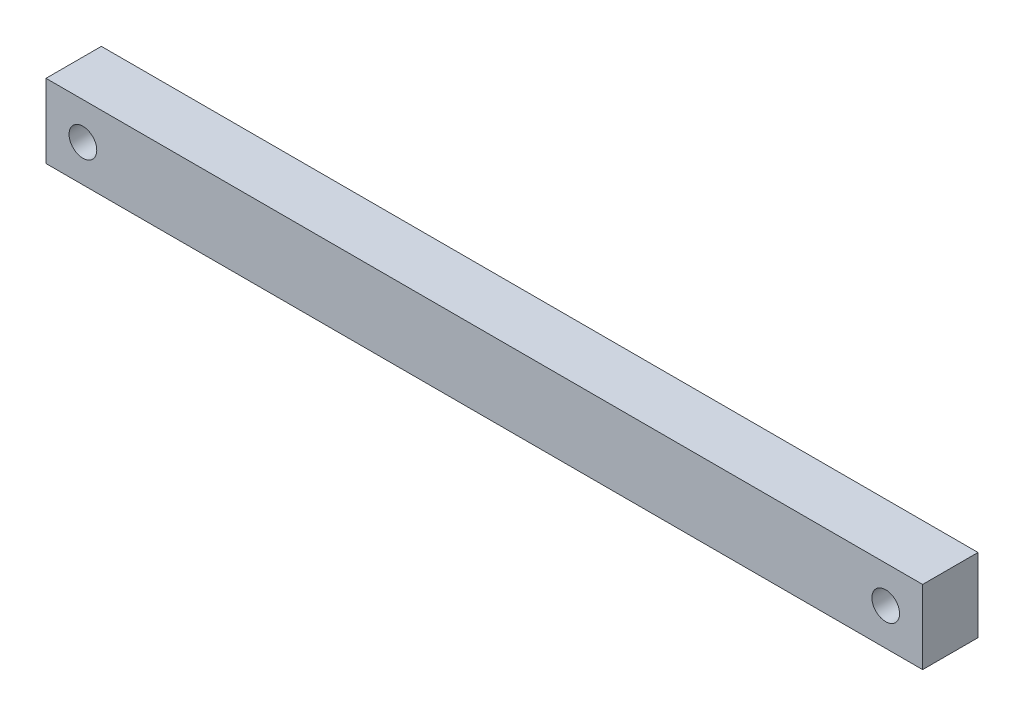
SolidWorks part; units mm, degrees
ref_plane "Plan de face" through (0, 0, 0) normal (0, 0, 1) x (1, 0, 0)
ref_plane "Plan de dessus" through (0, 0, 0) normal (0, 1, 0) x (1, 0, 0)
ref_plane "Plan de droite" through (0, 0, 0) normal (1, 0, 0) x (0, 0, -1)
sketch "Esquisse1" plane through (0, 0, 0) normal (0, 0, 1) x (1, 0, 0)
  line L0 (0, 0) -> (87, 87) construction
  line L1 (0, 0) -> (87, 0) construction
  line L2 (0, 0) -> (0, 87) construction
  line L3 (0, 87) -> (87, 87) construction
  line L4 (87, 0) -> (87, 87) construction
  line L5 (-4, 4.1007) -> (-4, -7.1235) construction
  line L6 (-6, -4) -> (93.9133, -4) construction
  line L7 (91, -7.1235) -> (91, 4.1007) construction
  line L9 (93.9133, 4) -> (-7.4978, 4) construction
  line L10 (-4, 4) -> (91, 4)
  line L11 (-4, 4) -> (-4, -4)
  line L12 (-4, -4) -> (91, -4)
  line L13 (91, 4) -> (91, -4)
  circle A0 centre (0, 0) radius 1.5
  circle A1 centre (87, 0) radius 1.5
  dimension "D1" = 4
  dimension "D2" = 8
extrude "Extrusion1" add sketch "Esquisse1" along normal blind 6
